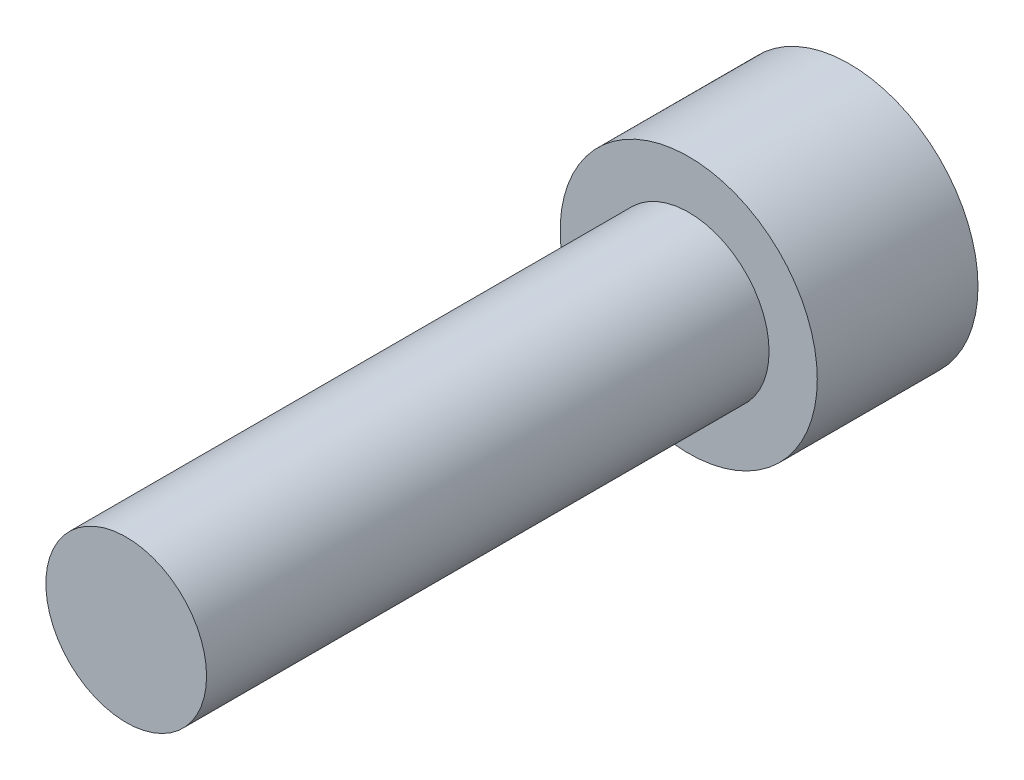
SolidWorks part; units mm, degrees
ref_plane "Front Plane" through (0, 0, 0) normal (0, 0, 1) x (1, 0, 0)
ref_plane "Top Plane" through (0, 0, 0) normal (0, 1, 0) x (1, 0, 0)
ref_plane "Right Plane" through (0, 0, 0) normal (1, 0, 0) x (0, 0, -1)
sketch "Sketch6" plane through (0, 0, 0) normal (1, 0, 0) x (0, 0, -1)
  line L0 (-35, 0) -> (22.525, 0) construction
  line L1 (8.8, 0) -> (-8.8, 0) construction
  line L2 (-35, 0) -> (-35, -5)
  line L3 (-35, -5) -> (0, -5)
  line L4 (0, 8.8) -> (0, -8.8) construction
  line L5 (0, -5) -> (0, -8)
  line L6 (0, -8) -> (10, -8)
  line L7 (10, -8) -> (10, 0)
  line L8 (10, 0) -> (-35, 0)
  dimension "L" = 35
  dimension "H" = 10
  dimension "A" = 16
  dimension "D" = 10
revolve "Revolve1" add sketch "Sketch6" angle 360 about L0
sketch "Sketch7" plane through (0, 0, -10) normal (0, 0, -1) x (-1, 0, 0)
  line L2 (-4, 2.3094) -> (-4, -2.3094)
  line L4 (-4, -2.3094) -> (0, -4.6188)
  line L5 (0, -4.6188) -> (4, -2.3094)
  line L6 (4, -2.3094) -> (4, 2.3094)
  line L7 (4, 2.3094) -> (0, 4.6188)
  line L8 (0, 4.6188) -> (-4, 2.3094)
  circle A0 centre (0, 0) radius 4 construction
  dimension "J" = 8
extrude "HEX" cut sketch "Sketch7" against normal blind 8
